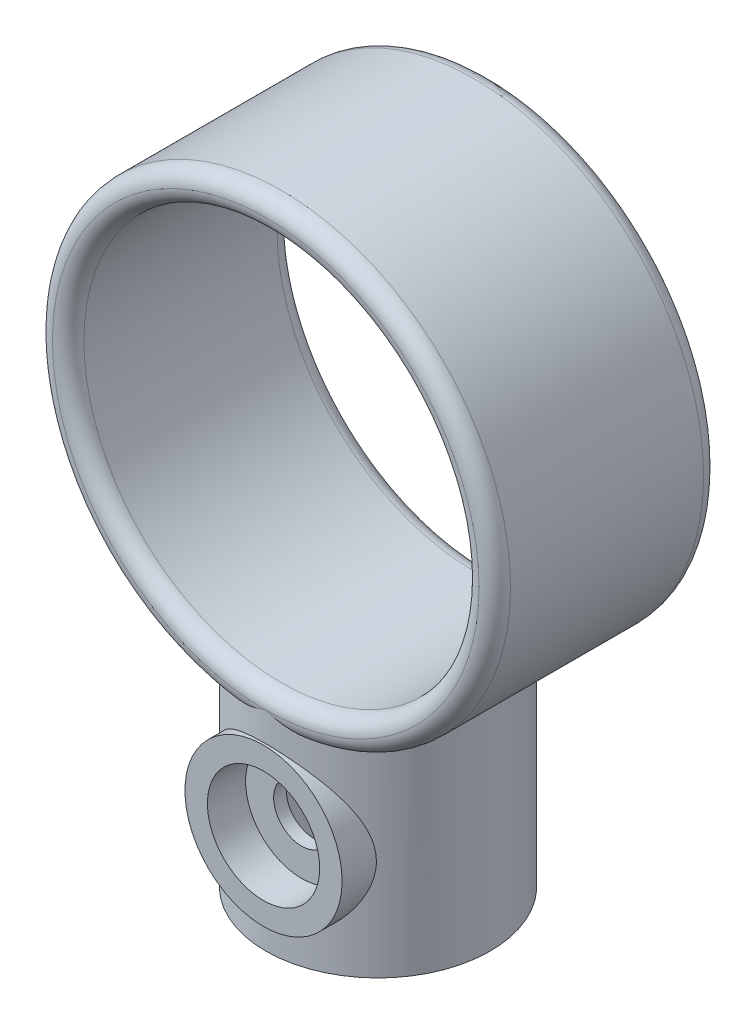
SolidWorks part; units mm, degrees
ref_plane "Front" through (0, 0, 0) normal (0, 0, 1) x (1, 0, 0)
ref_plane "Top" through (0, 0, 0) normal (0, 1, 0) x (1, 0, 0)
ref_plane "Right" through (0, 0, 0) normal (1, 0, 0) x (0, 0, -1)
sketch "Sketch1" plane through (0, 0, 0) normal (0, 0, 1) x (1, 0, 0)
  circle A0 centre (0, 0) radius 11.176
  dimension "D1" = 22.352
extrude "Base-Extrude" add sketch "Sketch1" along normal mid plane 12.7
shell "Shell1" thickness 1.778
fillet "Fillet1" radius 0.889 4 edges at (12.954, 0, -6.35) (12.954, 0, 6.35) (11.176, 0, -6.35) (11.176, 0, 6.35)
ref_plane "Plane4" through (0, -23.876, 0) normal (0, 1, 0) x (-1, 0, 0)
sketch "Sketch2" plane through (0, -23.876, 0) normal (0, 1, 0) x (-1, 0, 0)
  circle A0 centre (0, 0) radius 6.35
  dimension "D1" = 12.7
extrude "Boss-Extrude1" add sketch "Sketch2" along normal up to next
sketch "Sketch3" plane through (0, -23.876, 0) normal (0, -1, 0) x (1, 0, 0)
  line L0 (-1.5875, 3.6028) -> (1.5875, 3.6028)
  arc A0 (-1.5875, 3.6028) -> (1.5875, 3.6028) centre (0, 0) ccw
  dimension "D1" = 7.874
  dimension "D2" = 3.175
extrude "Cut-Extrude1" cut sketch "Sketch3" against normal blind 10.795
ref_plane "Plane5" through (0, -17.3714, 6.35) normal (0, 0, 1) x (-1, 0, 0)
ref_plane "Plane6" through (0, 0, 6.477) normal (0, 0, 1) x (1, 0, 0)
sketch "Sketch4" plane through (0, -17.3714, 6.477) normal (0, 0, 1) x (-1, 0, 0)
  line L0 (0, -4.2904) -> (0, 6.5046) construction
  line L1 (-50, 6.5046) -> (50, 6.5046) construction
  circle A0 centre (0, 0.7896) radius 4.445
  dimension "D1" = 8.89
  dimension "D2" = 1.27
extrude "Boss-Extrude2" add sketch "Sketch4" against normal up to surface (1.9422 mm away)
sketch "Sketch5" plane through (0, 0, 6.477) normal (0, 0, 1) x (1, 0, 0)
  circle A0 centre (0, -18.161) radius 3.175
  dimension "D1" = 6.35
extrude "Cut-Extrude2" cut sketch "Sketch5" against normal blind 2.159
sketch "Sketch6" plane through (0, 0, 4.318) normal (0, 0, 1) x (1, 0, 0)
  circle A0 centre (0, -18.161) radius 1.5875
  dimension "D1" = 3.175
extrude "Cut-Extrude3" cut sketch "Sketch6" against normal up to next
